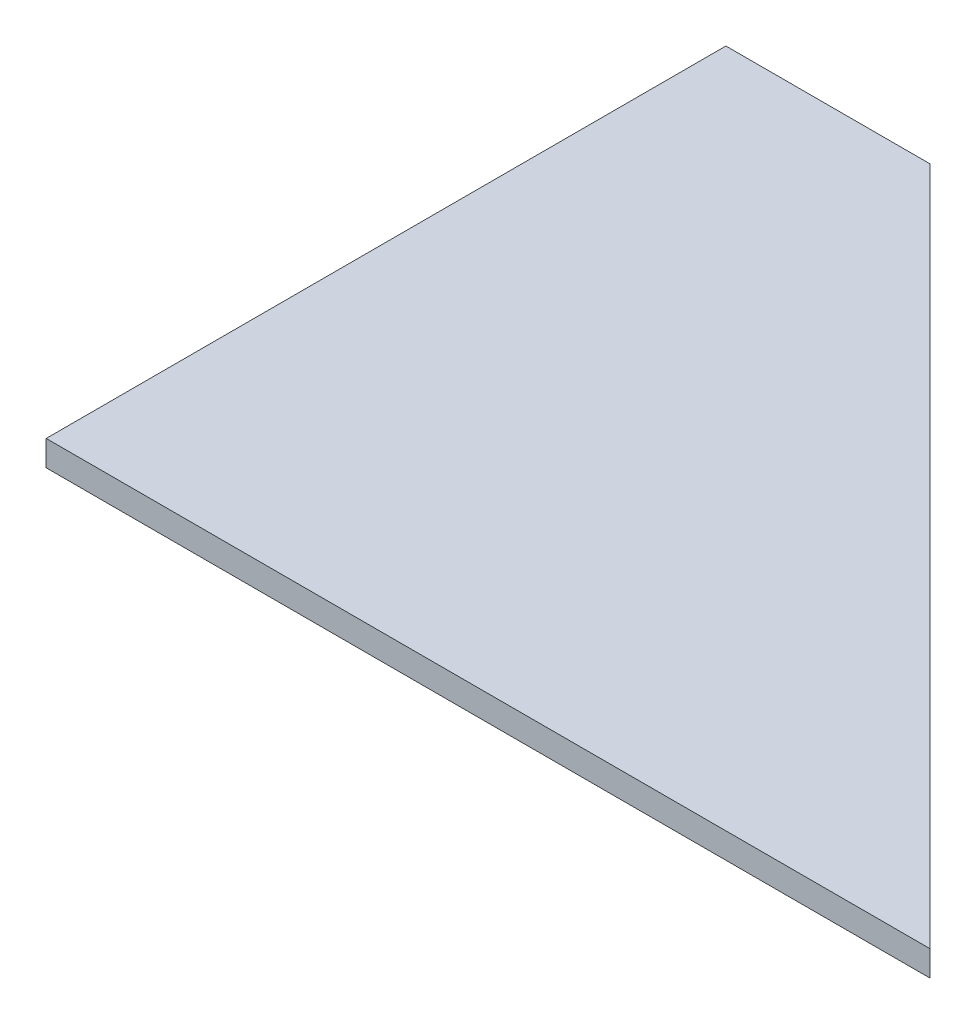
SolidWorks part; units mm, degrees
ref_plane "Front Plane" through (0, 0, 0) normal (0, 0, 1) x (1, 0, 0)
ref_plane "Top Plane" through (0, 0, 0) normal (0, 1, 0) x (1, 0, 0)
ref_plane "Right Plane" through (0, 0, 0) normal (1, 0, 0) x (0, 0, -1)
sketch "Sketch1" plane through (0, 0, 0) normal (0, 1, 0) x (1, 0, 0)
  line L0 (0, 0) -> (-254, 254)
  line L1 (-254, 254) -> (-330.2, 254)
  line L2 (-330.2, 254) -> (-330.2, 0)
  line L3 (-330.2, 0) -> (0, 0)
  dimension "D1" = 45
  dimension "D2" = 76.2
  dimension "D3" = 254
extrude "Boss-Extrude1" add sketch "Sketch1" along normal blind 9.525
